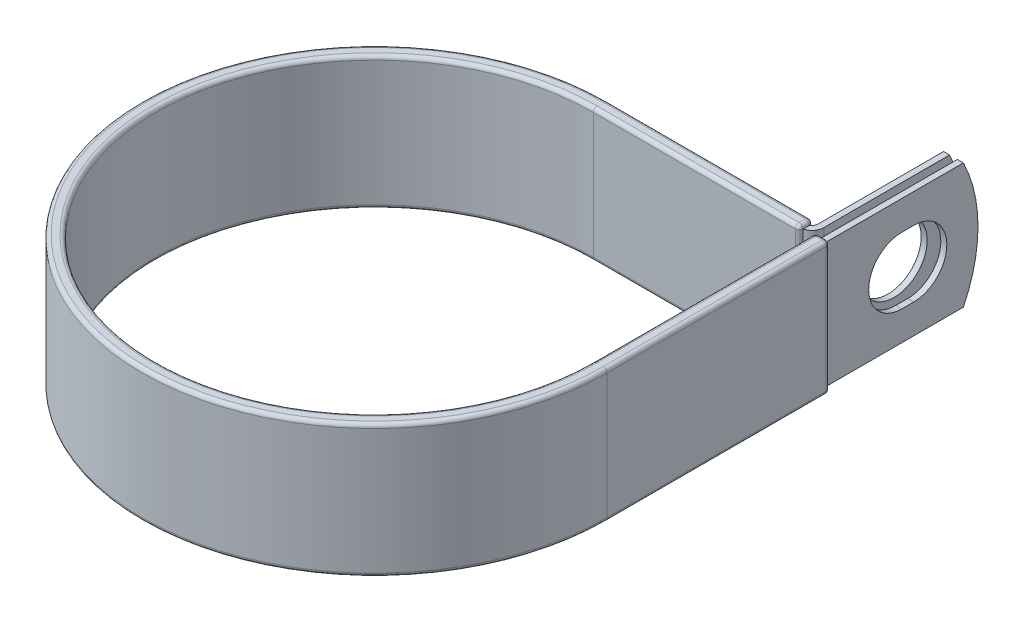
SolidWorks part; units mm, degrees
ref_plane "Front Plane" through (0, 0, 0) normal (0, 0, 1) x (1, 0, 0)
ref_plane "Top Plane" through (0, 0, 0) normal (0, 1, 0) x (1, 0, 0)
ref_plane "Right Plane" through (0, 0, 0) normal (1, 0, 0) x (0, 0, -1)
sketch "Sketch1" plane through (0, 0, 0) normal (0, 1, 0) x (1, 0, 0)
  line L0 (0, 45.2437) -> (41.2915, 45.2437)
  line L1 (45.2437, 0) -> (45.2437, 45.2437)
  line L2 (43.6689, 76.1746) -> (43.669, 47.6212)
  line L5 (45.2437, 45.2437) -> (45.2437, 76.1746)
  arc A0 (0, 45.2437) -> (45.2437, 0) centre (0, 0) ccw
  arc A3 (41.2915, 45.2437) -> (43.669, 47.6212) centre (41.2915, 47.6212) ccw
extrude "Extrude-Thin1" add sketch "Sketch1" along normal mid plane 25.4 thin
sketch "Sketch2" plane through (42.4498, 0, 0) normal (-1, 0, 0) x (0, 0, 1)
  line L0 (-76.1746, 12.7) -> (-76.1746, -12.7) construction
  line L7 (0, 12.7) -> (0, -12.7) construction
  circle A0 centre (-61.8998, 0) radius 6.7437
  point P2 (-76.1746, 0)
extrude "Cut-Extrude1" cut sketch "Sketch2" against normal up to surface (1.2192 mm away)
sketch "Sketch3" plane through (46.4629, 0, 0) normal (1, 0, 0) x (0, 0, -1)
  line L0 (60.706, 0) -> (63.0936, 0) construction
  line L1 (60.706, 6.7437) -> (63.0936, 6.7437)
  line L2 (60.706, -6.7437) -> (63.0936, -6.7437)
  line L3 (76.1746, 12.7) -> (76.1746, -12.7) construction
  arc A0 (60.706, 6.7437) -> (60.706, -6.7437) centre (60.706, 0) ccw
  arc A1 (63.0936, -6.7437) -> (63.0936, 6.7437) centre (63.0936, 0) ccw
  point P3 (61.8998, 0)
  point P8 (76.1746, 0)
  point P11 (53.9623, 0)
  point P12 (69.8373, 0)
extrude "Cut-Extrude2" cut sketch "Sketch3" against normal up to surface (1.2192 mm away)
sketch "Sketch4" plane through (42.4498, 0, 0) normal (-1, 0, 0) x (0, 0, 1)
  line L0 (-76.1746, 12.7) -> (-76.1746, -12.7)
  line L1 (-76.1746, 12.7) -> (-73.1973, 12.7)
  line L2 (-76.1746, 12.7) -> (-47.6212, 12.7) construction
  line L3 (-76.1746, -12.7) -> (-73.1973, -12.7)
  line L4 (-76.1746, -12.7) -> (-47.6212, -12.7) construction
  arc A0 (-73.1973, 12.7) -> (-73.1973, -12.7) centre (-47.5996, 0) ccw
extrude "Cut-Extrude3" cut sketch "Sketch4" against normal through all contours A0 M4 M5 | A0 L0 M2
ref_plane "Plane1" through (0, 0, -45.2437) normal (0, 0, 1) x (1, 0, 0)
ref_plane "Plane2" through (0, 0, 0) normal (-1, 0, 0) x (0, 0, 1)
sketch "Sketch5" plane through (0, 0, -45.2437) normal (0, 0, 1) x (1, 0, 0)
  line L0 (45.2437, 12.7) -> (46.4629, 12.7)
  line L1 (45.2437, -12.7) -> (45.2437, 12.7)
  line L2 (44.45, -12.7317) -> (44.45, 12.7317)
  line L3 (46.4629, 12.7) -> (46.4629, -12.7)
  line L4 (46.4629, -12.7) -> (45.2437, -12.7)
  line L5 (45.212, 13.4937) -> (46.4947, 13.4937)
  line L7 (47.2567, 12.7317) -> (47.2567, -12.7317)
  line L8 (46.4947, -13.4937) -> (45.212, -13.4937)
  line L9 (44.45, -13.4937) -> (44.45, 13.4937) construction
  line L11 (47.2567, -13.4937) -> (44.45, -13.4937) construction
  line L12 (47.2567, 13.4937) -> (47.2567, -13.4937) construction
  line L13 (44.45, 13.4937) -> (47.2567, 13.4937) construction
  arc A0 (44.45, -12.7317) -> (45.212, -13.4937) centre (45.212, -12.7317) ccw
  arc A1 (47.2567, -12.7317) -> (46.4947, -13.4937) centre (46.4947, -12.7317) cw
  arc A2 (44.45, 12.7317) -> (45.212, 13.4937) centre (45.212, 12.7317) cw
  arc A3 (46.4947, 13.4937) -> (47.2567, 12.7317) centre (46.4947, 12.7317) cw
sketch "Sketch6" plane through (0, 12.7, 0) normal (0, 1, 0) x (1, 0, 0)
  line L0 (44.45, 0) -> (44.45, 45.2437)
  line L1 (0, 44.45) -> (41.8148, 44.45)
  line L2 (42.4498, 73.1973) -> (42.4498, 47.6212) construction
  arc A0 (0, 44.45) -> (44.45, 0) centre (0, 0) ccw
sweep "Sweep1" add profiles "Sketch5" path "Sketch6"
fillet "Fillet1" radius 0.762 16 edges at (41.8148, 13.2706, -47.0335) (41.8148, 0, -47.2567) (41.8148, -13.2706, -47.0335) (41.8148, -13.4937, -45.8533) (41.8148, -13.2706, -44.6732) (41.8148, 0, -44.45) (41.8148, 13.2706, -44.6732) (47.0335, 13.2706, -45.2437) (47.2567, 0, -45.2437) (47.0335, -13.2706, -45.2437) (45.8533, -13.4937, -45.2437) (44.6732, -13.2706, -45.2437) (44.45, 0, -45.2437) (44.6732, 13.2706, -45.2437) (41.8148, 13.4937, -45.8533) (45.8533, 13.4937, -45.2437)
equation "\"D4@Sketch5\" = \"D1@Extrude-Thin1\""
equation "\"D5@Sketch5\" = \"D5@Extrude-Thin1\""
equation "\"D1@Sketch3\" = \"D2@Sketch2\""
equation "\"D7@Sketch1\" = \"D3@Sketch2\" + \"D1@Sketch3\""
equation "\"D1@Sketch1\" = \"D1@Sketch6\" + 2 * \"D3@Sketch5\""
equation "\"D1@Sketch4\" = ( \"D1@Extrude-Thin1\" + .125 ) * 2"
equation "\"D2@Sketch1\"=1.95*\"D5@Extrude-Thin1\""
equation "\"D2@Sketch3\" = \"D1@Sketch2\""
